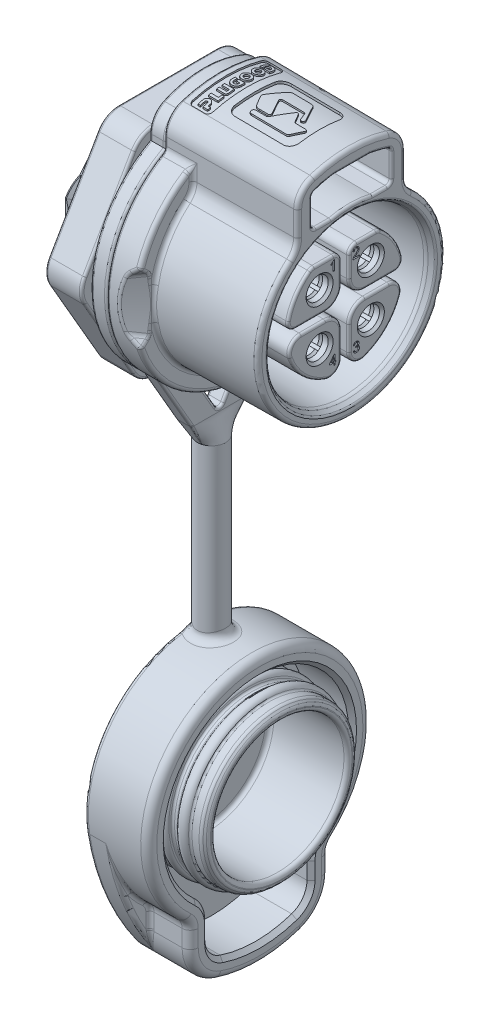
SolidWorks part; units mm, degrees
ref_plane "前视基准面" through (0, 0, 0) normal (0, 0, 1) x (1, 0, 0)
ref_plane "上视基准面" through (0, 0, 0) normal (0, 1, 0) x (1, 0, 0)
ref_plane "右视基准面" through (0, 0, 0) normal (1, 0, 0) x (0, 0, -1)
imported_body "PLG20 金属单孔座-1-solid1"
imported_body "PLG20 单孔座子防水垫_rev --1-solid1"
imported_body "PLG20 螺母-1-solid1"
imported_body "PLG20 4芯AB组件（加长针）-1/PLG20 4芯B件-1-solid1"
imported_body "PLG20 4芯AB组件（加长针）-1/PLG20 4芯A件-1-solid1"
imported_body "PLG20 4芯AB组件（加长针）-1/PLG20 4芯模块防水垫片-1-solid1"
imported_body "PLG20 4芯AB组件（加长针）-1/PLG20 2.6焊接加长母铜针-1-solid1"
imported_body "PLG20 4芯AB组件（加长针）-1/PLG20 2.6焊接加长母铜针-2-solid1"
imported_body "PLG20 4芯AB组件（加长针）-1/PLG20 2.6焊接加长母铜针-3-solid1"
imported_body "PLG20 4芯AB组件（加长针）-1/PLG20 2.6焊接加长母铜针-4-solid1"
sketch "草图1" plane through (0, 0, 0) normal (0, 0, 1) x (1, 0, 0)
  line L0 (0, 0) -> (-33.7361, 0) construction
  line L1 (-12.5542, 0) -> (-12.5542, 11.6847)
  line L2 (-12.5542, 11.6847) -> (-22.9, 11.6847)
  line L3 (-22.9, 11.6847) -> (-22.9, 9.2438)
  line L4 (-22.9, 9.2438) -> (-25.3992, 9.2438)
  line L5 (-25.3992, 9.2438) -> (-25.3992, 0)
  line L6 (-25.3992, 0) -> (-12.5542, 0)
revolve "旋转1" add sketch "草图1" angle 360 about L0
